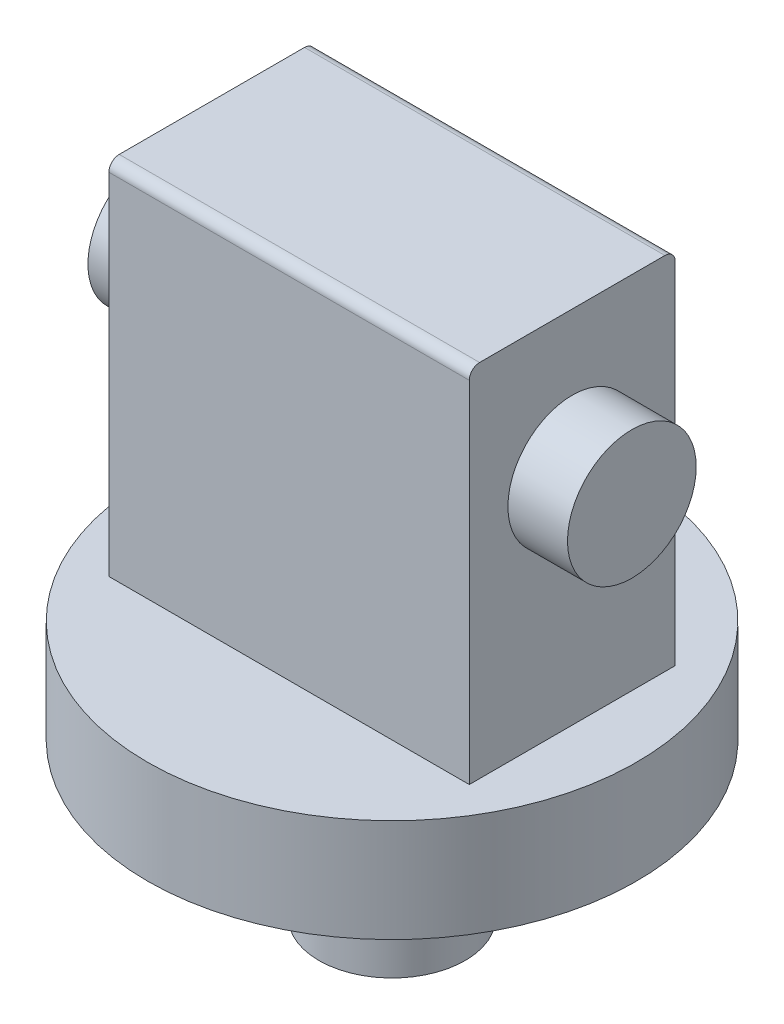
SolidWorks part; units mm, degrees
ref_plane "Front Plane" through (0, 0, 0) normal (0, 0, 1) x (1, 0, 0)
ref_plane "Top Plane" through (0, 0, 0) normal (0, 1, 0) x (1, 0, 0)
ref_plane "Right Plane" through (0, 0, 0) normal (1, 0, 0) x (0, 0, -1)
sketch "Sketch1" plane through (0, 0, 0) normal (0, 1, 0) x (1, 0, 0)
  circle A0 centre (0, 0) radius 60.325
  dimension "D1" = 120.65
extrude "Boss-Extrude1" add sketch "Sketch1" along normal blind 25.4
sketch "Sketch4" plane through (0, 25.4, 0) normal (0, 1, 0) x (1, 0, 0)
  line L1 (-44.45, 25.4) -> (44.45, 25.4)
  line L2 (-44.45, 25.4) -> (-44.45, -25.4)
  line L3 (-44.45, -25.4) -> (44.45, -25.4)
  line L4 (44.45, 25.4) -> (44.45, -25.4)
  line L5 (-44.45, 25.4) -> (44.45, -25.4) construction
  line L6 (-44.45, -25.4) -> (44.45, 25.4) construction
  point P0 (0, 0)
  dimension "D1" = 88.9
  dimension "D2" = 50.8
extrude "Boss-Extrude2" add sketch "Sketch4" along normal blind 88.9
sketch "Sketch6" plane through (44.45, 0, 0) normal (1, 0, 0) x (0, 0, -1)
  line L0 (0, 114.3) -> (0, 25.4) construction
  line L1 (-25.4, 114.3) -> (25.4, 114.3) construction
  line L2 (60.325, 25.4) -> (-60.325, 25.4) construction
  line L3 (-25.4, 114.3) -> (-25.4, 25.4) construction
  circle A0 centre (0, 80.01) radius 15.875
  dimension "D1" = 31.75
  dimension "D2" = 25.4
  dimension "D3" = 34.29
extrude "Boss-Extrude3" add sketch "Sketch6" along normal blind 14.7
mirror "Mirror1" about plane through (0, 0, 0) normal (1, 0, 0) of "Boss-Extrude3"
sketch "Sketch7" plane through (0, 0, 0) normal (0, -1, 0) x (1, 0, 0)
  circle A0 centre (0, 0) radius 18.05
  dimension "D1" = 36.1
extrude "Boss-Extrude4" add sketch "Sketch7" along normal blind 38.1
fillet "Fillet1" radius 2.54 2 edges at (0, 114.3, -25.4) (0, 114.3, 25.4)
